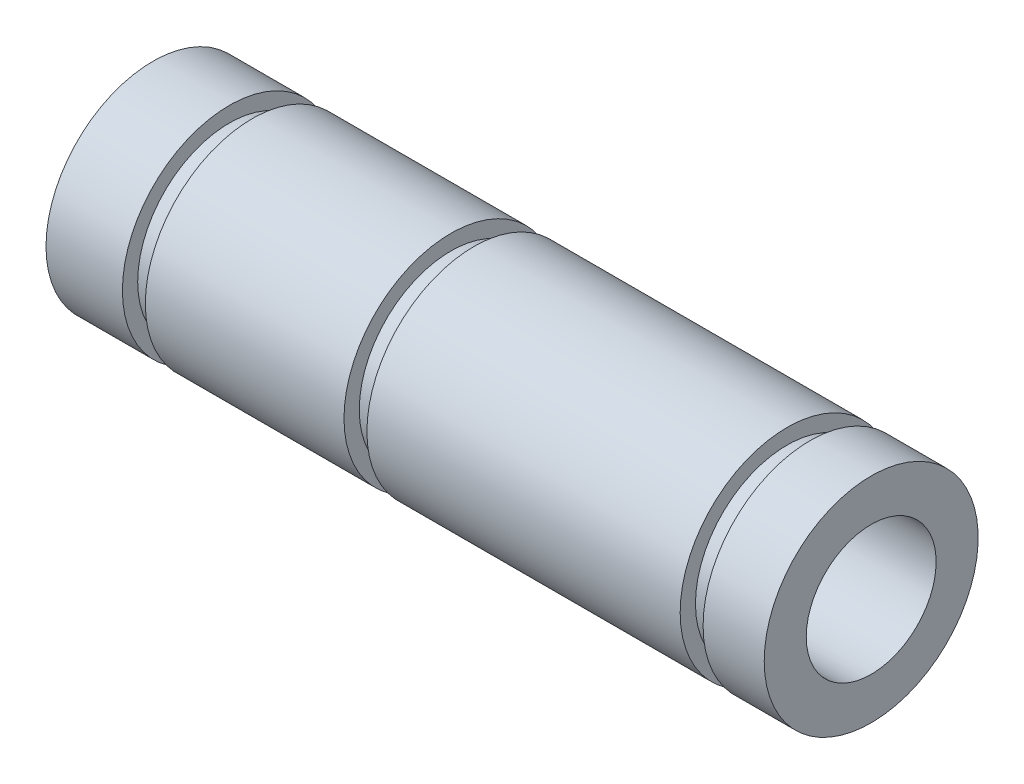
SolidWorks part; units mm, degrees
ref_plane "Plan de face" through (0, 0, 0) normal (0, 0, 1) x (1, 0, 0)
ref_plane "Plan de dessus" through (0, 0, 0) normal (0, 1, 0) x (1, 0, 0)
ref_plane "Plan de droite" through (0, 0, 0) normal (1, 0, 0) x (0, 0, -1)
sketch "Esquisse1" plane through (0, 0, 0) normal (0, 0, 1) x (1, 0, 0)
  line L0 (0, 0) -> (55.2561, 0) construction
  line L1 (0, 7) -> (5, 7)
  line L2 (0, 4.25) -> (47, 4.25)
  line L3 (0, 4.25) -> (0, 7)
  line L4 (6.5, 7) -> (19.5, 7)
  line L5 (47, 4.25) -> (47, 7)
  line L6 (21, 7) -> (41.5, 7)
  line L8 (5, 7) -> (5, 6)
  line L9 (5, 6) -> (6.5, 6)
  line L10 (43, 7) -> (47, 7)
  line L11 (19.5, 7) -> (19.5, 6)
  line L12 (19.5, 6) -> (21, 6)
  line L13 (21, 7) -> (21, 6)
  line L14 (6.5, 7) -> (6.5, 6)
  line L15 (41.5, 7) -> (41.5, 6)
  line L16 (41.5, 6) -> (43, 6)
  line L17 (43, 7) -> (43, 6)
  dimension "D1" = 8.5
  dimension "D2" = 14
  dimension "D3" = 12
  dimension "D4" = 1.5
  dimension "D5" = 1.5
  dimension "D6" = 1.5
  dimension "D7" = 47
  dimension "D8" = 4
  dimension "D9" = 20.5
  dimension "D10" = 13
revolve "Révolution1" add sketch "Esquisse1" angle 360 about L0
